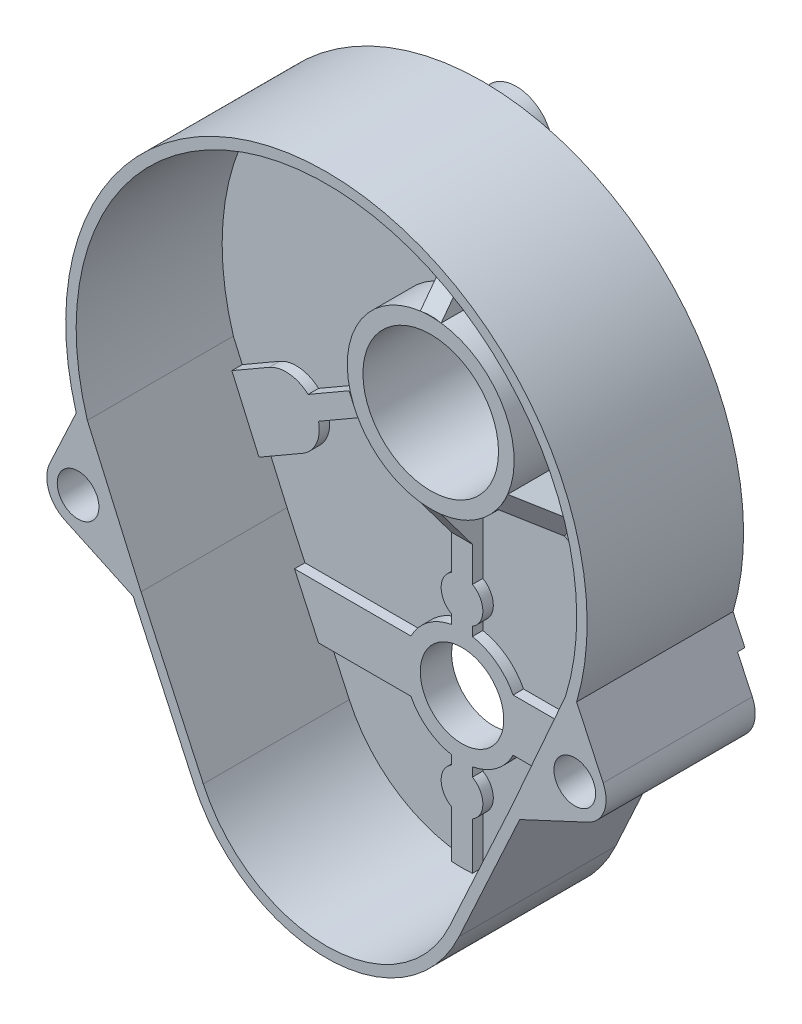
SolidWorks part; units mm, degrees
ref_plane "FACE" through (0, 0, 0) normal (0, 0, 1) x (1, 0, 0)
ref_plane "DESSUS" through (0, 0, 0) normal (0, 1, 0) x (1, 0, 0)
ref_plane "GAUCHE" through (0, 0, 0) normal (1, 0, 0) x (0, 0, -1)
sketch "Esquisse1" plane through (0, 0, 0) normal (0, 0, 1) x (1, 0, 0)
  line L0 (0, 0) -> (0, -58) construction
  line L1 (0, 0) -> (0, 27) construction
  line L2 (-18.5332, -19.5234) -> (-12.7166, -32.1555)
  line L3 (0, 0) -> (31.225, -18.0278) construction
  line L4 (18.5332, -19.5234) -> (12.7166, -32.1555)
  line L5 (26.5346, -12.4821) -> (23.9916, -7.0287)
  line L6 (25.0836, -16.4689) -> (18.5332, -19.5234)
  line L7 (-25.0836, -16.4689) -> (-18.5332, -19.5234)
  line L8 (-26.5346, -12.4821) -> (-23.9916, -7.0287)
  arc A0 (23.9916, -7.0287) -> (-23.9916, -7.0287) centre (0, 0) ccw
  arc A1 (-12.7166, -32.1555) -> (12.7166, -32.1555) centre (0, -26.3) ccw
  arc A2 (25.0836, -16.4689) -> (26.5346, -12.4821) centre (23.8157, -13.75) ccw
  circle A3 centre (23.8157, -13.75) radius 2
  arc A4 (-25.0836, -16.4689) -> (-26.5346, -12.4821) centre (-23.8157, -13.75) cw
  circle A5 centre (-23.8157, -13.75) radius 2
  dimension "D1" = 50
  dimension "D2" = 28
  dimension "D5" = 6
  dimension "D7" = 4
  dimension "D3" = 26.3
  dimension "D4" = 60
  dimension "D6" = 27.5
extrude "Base-Extrusion" add sketch "Esquisse1" along normal blind 15
shell "Coque1" thickness 1
sketch "Esquisse2" plane through (0, 0, 0) normal (0, 0, -1) x (-1, 0, 0)
  circle A0 centre (0, 0) radius 8
  dimension "D1" = 16
extrude "Boss.-Extru.1" add sketch "Esquisse2" along normal blind 8.2
sketch "Esquisse3" plane through (0, 0, 0) normal (0, 0, -1) x (-1, 0, 0)
  line L0 (0, 0) -> (0, 27) construction
  circle A0 centre (0, 19.5) radius 3.5
  dimension "D1" = 7
  dimension "D2" = 19.5
extrude "Boss.-Extru.2" add sketch "Esquisse3" along normal blind 3.2
pattern_circular "Répétition circulaire1" count 3 every 120
sketch "Esquisse4" plane through (0, 0, 0) normal (0, 0, -1) x (-1, 0, 0)
  line L0 (0, 0) -> (0, -43) construction
  circle A0 centre (0, -25) radius 5.5
  dimension "D1" = 11
  dimension "D2" = 25
extrude "Boss.-Extru.3" add sketch "Esquisse4" along normal blind 1
sketch "Esquisse5" plane through (0, 0, 0) normal (0, 0, -1) x (-1, 0, 0)
  line L0 (-20.3157, -13.75) -> (-20.3157, -18.6922)
  line L1 (-22.5158, -10.5003) -> (-25.124, -9.4571)
  line L2 (-18.5332, -19.5234) -> (-25.0836, -16.4689) construction
  line L3 (-26.5346, -12.4821) -> (-23.9916, -7.0287) construction
  line L4 (-20.3157, -18.6922) -> (-25.0836, -16.4689)
  line L5 (-26.5346, -12.4821) -> (-25.124, -9.4571)
  arc A0 (-20.3157, -13.75) -> (-22.5158, -10.5003) centre (-23.8157, -13.75) ccw
  circle A1 centre (-23.8157, -13.75) radius 2 construction
  arc A2 (-26.5346, -12.4821) -> (-25.0836, -16.4689) centre (-23.8157, -13.75) ccw construction
  arc A3 (-26.5346, -12.4821) -> (-25.0836, -16.4689) centre (-23.8157, -13.75) ccw
  circle A4 centre (-23.8157, -13.75) radius 2
  dimension "D1" = 7
extrude "Enlèv. mat.-Extru.1" cut sketch "Esquisse5" against normal blind 0.7
mirror "Symétrie1" about plane through (0, 0, 0) normal (1, 0, 0)
hole_wizard "Perçage1" positions "Esquisse7" profile "Esquisse6" tap size "M3x0.5" standard "ISO"
sketch "Esquisse7" plane through (0, 0, -3.2) normal (0, 0, -1) x (-1, 0, 0)
  circle A0 centre (0, 19.5) radius 3.5 construction
  point P0 (0, 19.5)
sketch "Esquisse6" plane through (0, 19.5, -3.2) normal (1, 0, 0) x (0, 1, 0)
  line L0 (0, 0) -> (0, 9.2217)
  line L1 (0, 9.2217) -> (1.25, 8.5)
  line L2 (1.25, 8.5) -> (1.25, 0)
  line L5 (1.25, 0) -> (0, 0)
  line L10 (0, 9.2217) -> (-1.25, 8.5) construction
  line L11 (0, -6.35) -> (0, 107.95) construction
  dimension "Diamètre du perçage" = 2.5
  dimension "Profondeur du perçage" = 8.5
  dimension "Angle de pointe" = 120
pattern_circular "Répétition circulaire2" count 3 every 120
sketch "Esquisse8" plane through (0, 0, -1) normal (0, 0, -1) x (-1, 0, 0)
  circle A0 centre (0, -25) radius 4
  circle A1 centre (0, -25) radius 5.5 construction
  dimension "D1" = 8
extrude "Enlèv. mat.-Extru.2" cut sketch "Esquisse8" against normal through all
sketch "Esquisse9" plane through (0, 0, -8.2) normal (0, 0, -1) x (-1, 0, 0)
  circle A0 centre (0, 0) radius 6.5
  dimension "D1" = 13
extrude "Enlèv. mat.-Extru.3" cut sketch "Esquisse9" against normal through all
sketch "Esquisse10" plane through (0, 0, 0) normal (0, 0, -1) x (-1, 0, 0)
  line L0 (0, 50) -> (0, -50) construction
  circle A0 centre (0, -34.8) radius 1.4
  dimension "D1" = 2.8
  dimension "D2" = 8.5
extrude "Boss.-Extru.4" add sketch "Esquisse10" along normal blind 3.8
sketch "Esquisse11" plane through (0, 0, 1) normal (0, 0, 1) x (1, 0, 0)
  circle A0 centre (0, 0) radius 6.5 construction
  circle A1 centre (0, 0) radius 6.5
  circle A2 centre (0, 0) radius 8
  dimension "D1" = 16
extrude "Boss.-Extru.5" add sketch "Esquisse11" along normal blind 4
sketch "Esquisse12" plane through (0, 0, 1) normal (0, 0, 1) x (1, 0, 0)
  line L0 (-1, 16.4603) -> (-1, 7.9373)
  line L1 (1, 16.4603) -> (1, 7.9373)
  line L2 (3.2, 19.5) -> (3.2, 24.7944)
  line L3 (-3.2, 19.5) -> (-3.2, 24.7944)
  arc A0 (-3.2, 19.5) -> (-1, 16.4603) centre (0, 19.5) ccw
  circle A1 centre (0, 19.5) radius 1.25 construction
  arc A3 (23.9916, -7.0287) -> (-23.9916, -7.0287) centre (0, 0) ccw construction
  circle A4 centre (0, 0) radius 8 construction
  arc A5 (1, 7.9373) -> (-1, 7.9373) centre (0, 0) ccw
  arc A6 (1, 16.4603) -> (3.2, 19.5) centre (0, 19.5) ccw
  arc A7 (3.2, 24.7944) -> (-3.2, 24.7944) centre (0, 0) ccw
  dimension "D1" = 6.4
  dimension "D2" = 2
  dimension "D3" = 2.2
extrude "Boss.-Extru.6" add sketch "Esquisse12" along normal blind 1
pattern_circular "Répétition circulaire3" count 3 every 120
sketch "Esquisse13" plane through (0, 0, 1) normal (0, 0, 1) x (1, 0, 0)
  line L0 (17.7783, -18.7721) -> (22.6344, -16.5076) construction
  line L1 (24.6833, -10.8782) -> (22.9241, -7.1055) construction
  line L2 (17.7783, -18.7721) -> (22.6344, -16.5076)
  line L3 (24.6833, -10.8782) -> (22.9241, -7.1055)
  line L4 (22.9241, -7.1055) -> (17.7783, -18.7721)
  arc A0 (24.6833, -10.8782) -> (22.6344, -16.5076) centre (23.8157, -13.75) ccw construction
  arc A1 (24.6833, -10.8782) -> (22.6344, -16.5076) centre (23.8157, -13.75) ccw
extrude "Boss.-Extru.7" add sketch "Esquisse13" along normal up to next
sketch "Esquisse14" plane through (0, 0, 1) normal (0, 0, 1) x (1, 0, 0)
  line L0 (-22.6344, -16.5076) -> (-17.7783, -18.7721) construction
  line L1 (-22.9241, -7.1055) -> (-24.6833, -10.8782) construction
  line L2 (-22.6344, -16.5076) -> (-17.7783, -18.7721)
  line L3 (-22.9241, -7.1055) -> (-24.6833, -10.8782)
  line L4 (-22.9241, -7.1055) -> (-17.7783, -18.7721)
  arc A0 (-22.6344, -16.5076) -> (-24.6833, -10.8782) centre (-23.8157, -13.75) ccw construction
  arc A1 (-22.6344, -16.5076) -> (-24.6833, -10.8782) centre (-23.8157, -13.75) ccw
extrude "Boss.-Extru.8" add sketch "Esquisse14" along normal blind 14
sketch "Esquisse15" plane through (0, 0, 1) normal (0, 0, 1) x (1, 0, 0)
  line L0 (-1, -7.9373) -> (-1, -15.2679)
  line L1 (1, -7.9373) -> (1, -15.2679)
  line L2 (-16.0617, -22.5) -> (-4.899, -22.5)
  line L3 (-13.7594, -27.5) -> (-4.899, -27.5)
  line L4 (1, 7.9373) -> (1, 16.4603) construction
  line L5 (-1, 16.4603) -> (-1, 7.9373) construction
  line L6 (11.8083, -31.7373) -> (17.7783, -18.7721) construction
  line L7 (-17.7783, -18.7721) -> (-11.8083, -31.7373) construction
  line L8 (13.7594, -27.5) -> (16.0617, -22.5)
  line L9 (-16.0617, -22.5) -> (-13.7594, -27.5)
  line L10 (-1, -18.7321) -> (-1, -19.5917)
  line L11 (1, -18.7321) -> (1, -19.5917)
  line L12 (-1, -30.4083) -> (-1, -31.2679)
  line L13 (4.899, -22.5) -> (16.0617, -22.5)
  line L14 (1, -30.4083) -> (1, -31.2679)
  line L15 (4.899, -27.5) -> (13.7594, -27.5)
  line L16 (1, -34.7321) -> (1, -39.2615)
  line L17 (-1, -34.7321) -> (-1, -39.2615)
  arc A0 (4.899, -22.5) -> (1, -19.5917) centre (0, -25) ccw
  arc A1 (-1, -19.5917) -> (-4.899, -22.5) centre (0, -25) ccw
  circle A2 centre (0, -25) radius 4
  arc A3 (-1, -15.2679) -> (-1, -18.7321) centre (0, -17) ccw
  arc A4 (1, -34.7321) -> (1, -31.2679) centre (0, -33) ccw
  circle A6 centre (0, 0) radius 8 construction
  arc A7 (-11.8083, -31.7373) -> (11.8083, -31.7373) centre (0, -26.3) ccw construction
  arc A8 (-1, -7.9373) -> (1, -7.9373) centre (0, 0) ccw
  arc A9 (1, -18.7321) -> (1, -15.2679) centre (0, -17) ccw
  arc A10 (-4.899, -27.5) -> (-1, -30.4083) centre (0, -25) ccw
  arc A11 (-1, -31.2679) -> (-1, -34.7321) centre (0, -33) ccw
  arc A12 (1, -30.4083) -> (4.899, -27.5) centre (0, -25) ccw
  circle A13 centre (0, -25) radius 4 construction
  arc A14 (-1, -39.2615) -> (1, -39.2615) centre (0, -26.3) ccw
  dimension "D1" = 11
  dimension "D4" = 4
  dimension "D5" = 4
  dimension "D10" = 8
  dimension "D2" = 5
  dimension "D3" = 2.5
  dimension "D6" = 8
  dimension "D7" = 8
  dimension "D8" = 1
  dimension "D9" = 1
extrude "Boss.-Extru.9" add sketch "Esquisse15" along normal blind 1
sketch "Esquisse17" plane through (0, 0, 0) normal (1, 0, 0) x (0, 0, -1)
  line L0 (-2, 7.9373) -> (-1, 7.9373) construction
  line L1 (-5, 7.9373) -> (-2, 7.9373)
  line L3 (-5, 8) -> (-5, -8) construction
  line L4 (-2, 7.9373) -> (-2, 16.4603) construction
  line L5 (-2, 7.9373) -> (-2, 11.9373)
  line L6 (-5, 7.9373) -> (-2, 11.9373)
  point P2 (0, 0)
  dimension "D1" = 4
extrude "Boss.-Extru.10" add sketch "Esquisse17" along normal mid plane 2
pattern_circular "Répétition circulaire4" count 3 every 120
pattern_circular "Répétition circulaire5" count 2 every 180
